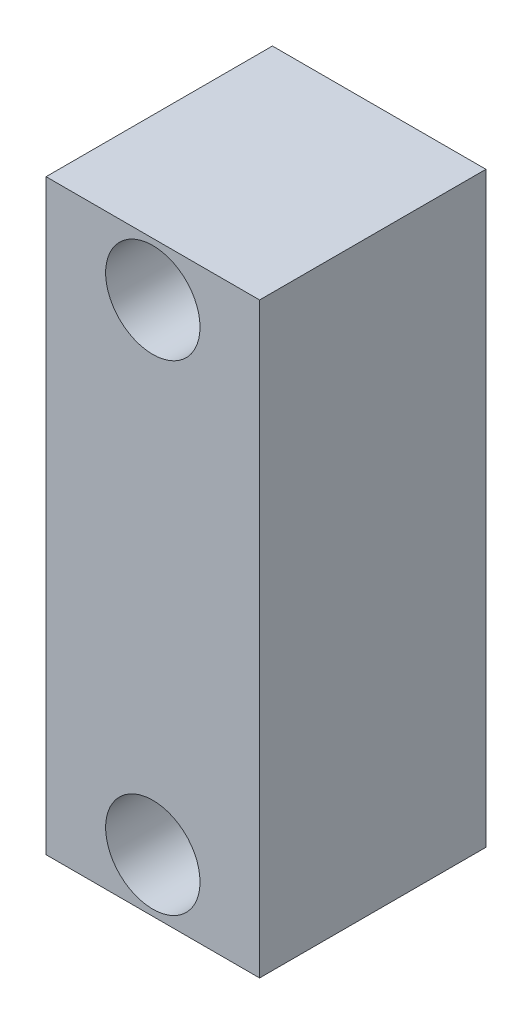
SolidWorks part; units mm, degrees
ref_plane "Front/Back" through (0, 0, 0) normal (0, 0, 1) x (1, 0, 0)
ref_plane "Top/Bottom" through (0, 0, 0) normal (0, 1, 0) x (1, 0, 0)
ref_plane "Right/Left" through (0, 0, 0) normal (1, 0, 0) x (0, 0, -1)
sketch "Sketch1" plane through (0, 0, 0) normal (0, 0, 1) x (1, 0, 0)
  line L0 (0, 0) -> (12.7, 0) construction
  line L1 (-12.7, 34.925) -> (12.7, 34.925)
  line L2 (-12.7, 34.925) -> (-12.7, -34.925)
  line L3 (-12.7, -34.925) -> (12.7, -34.925)
  line L4 (12.7, 34.925) -> (12.7, -34.925)
  line L5 (0, 0) -> (0, 34.925) construction
  dimension "D1" = 25.4
  dimension "D2" = 69.85
extrude "Extrude1" add sketch "Sketch1" along normal mid plane 26.924
hole_wizard "CBORE for M8 SHCS1" positions "Sketch3" profile "Sketch2" counterbore size "M8" standard "Ansi Metric"
sketch "Sketch3" plane through (0, 0, 13.462) normal (0, 0, 1) x (1, 0, 0)
  line L0 (0, 0) -> (0, 36.8877) construction
  line L1 (0, 0) -> (26.0835, 0) construction
  point P0 (0, 28.575)
  point P1 (0, -28.575)
  dimension "D1" = 57.15
sketch "Sketch2" plane through (0, 28.575, 13.462) normal (1, 0, 0) x (0, -1, 0)
  line L0 (0, 0) -> (0, 26.924)
  line L1 (0, 26.924) -> (4.5, 26.924)
  line L3 (4.5, 26.924) -> (4.5, 8)
  line L4 (4.5, 8) -> (5.6134, 8)
  line L5 (5.6134, 8) -> (5.6134, 0)
  line L7 (5.6134, 0) -> (0, 0)
  line L11 (0, -6.35) -> (0, 107.95) construction
  dimension "Thru Hole Dia." = 9
  dimension "Thru Hole Depth" = 26.924
  dimension "C'Bore Dia." = 11.2268
  dimension "C'Bore Depth" = 8
